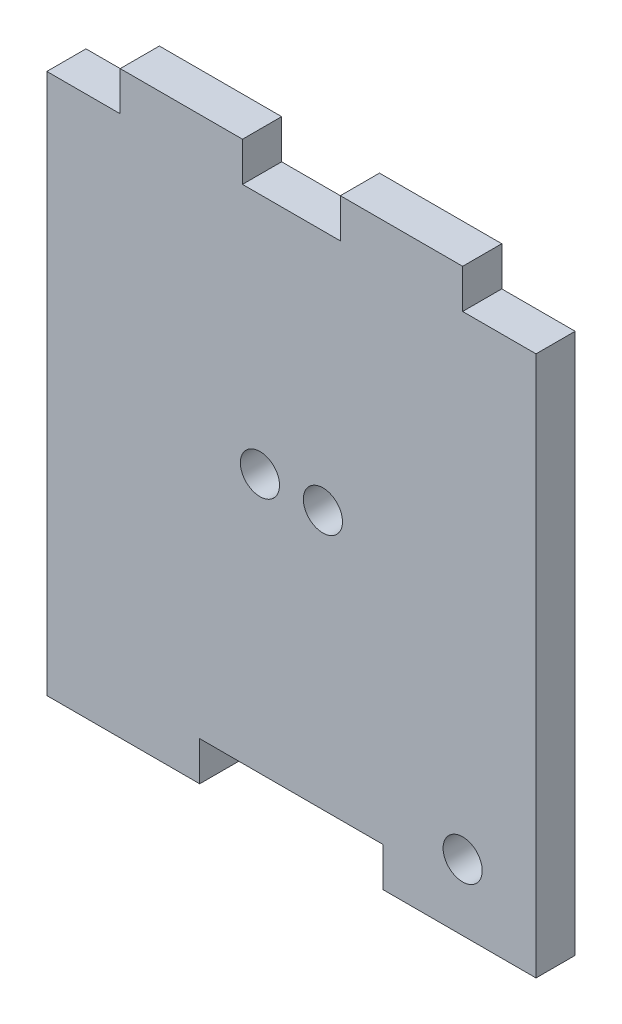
SolidWorks part; units mm, degrees
ref_plane "Front Plane" through (0, 0, 0) normal (0, 0, 1) x (1, 0, 0)
ref_plane "Top Plane" through (0, 0, 0) normal (0, 1, 0) x (1, 0, 0)
ref_plane "Right Plane" through (0, 0, 0) normal (1, 0, 0) x (0, 0, -1)
sketch "Sketch1" plane through (0, 0, 0) normal (0, 0, 1) x (1, 0, 0)
  line L0 (100, 221) -> (100, 248.4414) construction
  line L1 (0, 0) -> (62.5, 0)
  line L2 (0, 0) -> (0, 221)
  line L3 (0, 221) -> (200, 221)
  line L4 (200, 0) -> (200, 221)
  line L5 (137.5, 0) -> (200, 0)
  line L6 (170, 221) -> (120, 221)
  line L7 (170, 221) -> (170, 237)
  line L8 (170, 237) -> (120, 237)
  line L9 (120, 221) -> (120, 237)
  line L10 (80, 221) -> (80, 237)
  line L11 (30, 237) -> (80, 237)
  line L12 (30, 221) -> (30, 237)
  line L13 (30, 221) -> (80, 221)
  line L14 (100, 221) -> (100, 16) construction
  line L15 (137.5, 16) -> (200, 16) construction
  line L16 (100, 16) -> (100, 122)
  line L23 (62.5, 0) -> (62.5, 16)
  line L24 (62.5, 16) -> (137.5, 16)
  line L25 (137.5, 0) -> (137.5, 16)
  line L26 (100, 122) -> (104.87, 122)
  line L27 (100, 122) -> (95.13, 122)
  circle A0 centre (112.87, 122) radius 8
  circle A1 centre (87.13, 122) radius 8
  circle A4 centre (170, 27) radius 8
  point P20 (204.0547, 0.522)
extrude "Boss-Extrude1" add sketch "Sketch1" along normal blind 16
equation "\"thk\"= 16mm"
equation "\"D4@Sketch1\"=\"thk\""
equation "\"D1@Boss-Extrude1\"=\"thk\""
equation "\"D8@Sketch1\"=\"thk\""
